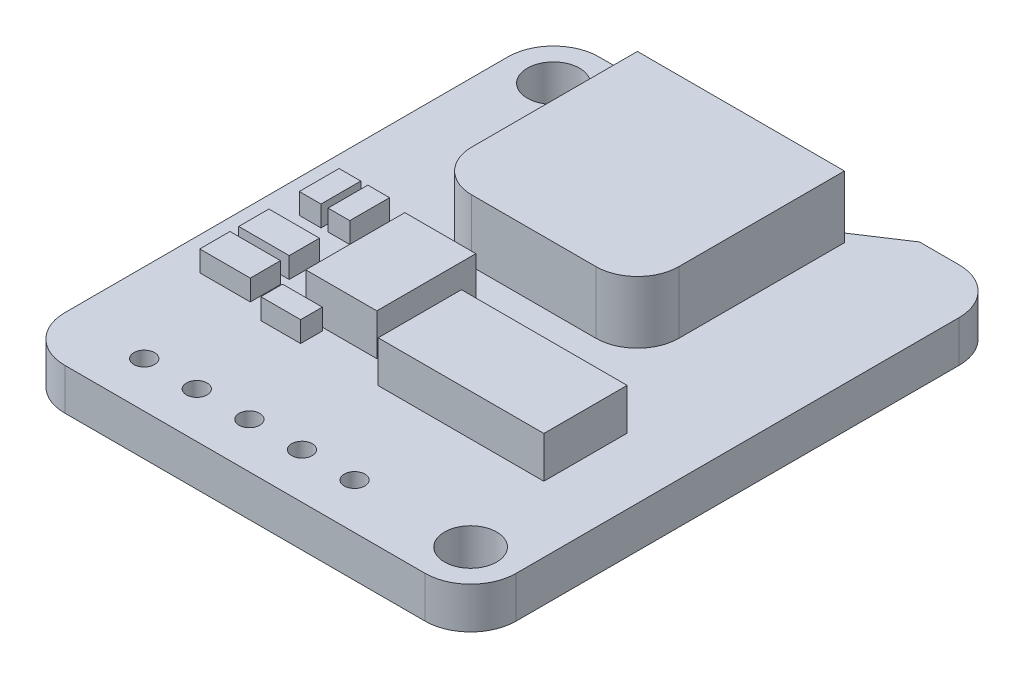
SolidWorks part; units mm, degrees
ref_plane "Front Plane" through (0, 0, 0) normal (0, 0, 1) x (1, 0, 0)
ref_plane "Top Plane" through (0, 0, 0) normal (0, 1, 0) x (1, 0, 0)
ref_plane "Right Plane" through (0, 0, 0) normal (1, 0, 0) x (0, 0, -1)
sketch "Sketch1" plane through (0, 0, 0) normal (0, 1, 0) x (1, 0, 0)
  line L0 (4.4809, 25.8) -> (6.2682, 24.0127)
  line L1 (2.2, 0) -> (19.6, 0)
  line L2 (0, 2.2) -> (0, 23.6)
  line L3 (2.2, 25.8) -> (4.4809, 25.8)
  line L4 (21.8, 2.2) -> (21.8, 23.6)
  line L5 (7.6824, 23.4269) -> (13.4754, 23.4269)
  line L6 (14.5743, 23.7558) -> (17.6827, 25.8)
  line L7 (17.6827, 25.8) -> (19.6, 25.8)
  line L8 (3.8369, 2.2) -> (6.3769, 2.2) construction
  arc A0 (0, 23.6) -> (2.2, 25.8) centre (2.2, 23.6) cw
  arc A1 (19.6, 25.8) -> (21.8, 23.6) centre (19.6, 23.6) cw
  arc A2 (19.6, 0) -> (21.8, 2.2) centre (19.6, 2.2) ccw
  arc A3 (2.2, 0) -> (0, 2.2) centre (2.2, 2.2) cw
  arc A4 (13.4754, 23.4269) -> (14.5743, 23.7558) centre (13.4754, 25.4269) ccw
  arc A5 (6.2682, 24.0127) -> (7.6824, 23.4269) centre (7.6824, 25.4269) ccw
  circle A6 centre (2.2, 23.6) radius 1.2596
  circle A7 centre (19.6, 2.2) radius 1.2596
  circle A8 centre (3.8369, 2.2) radius 0.5
  circle A9 centre (6.3769, 2.2) radius 0.5
  circle A10 centre (8.9169, 2.2) radius 0.5
  circle A11 centre (11.4569, 2.2) radius 0.5
  circle A12 centre (13.9969, 2.2) radius 0.5
  point P9 (21.8, 25.8)
  point P12 (21.8, 0)
  point P15 (0, 0)
  dimension "D3" = 2.2
  dimension "D4" = 2
  dimension "D5" = 1
  dimension "D1" = 21.8
  dimension "D2" = 25.8
  dimension "D7" = 2.54
  dimension "D6" = 5
extrude "Board" add sketch "Sketch1" along normal blind 2
sketch "Sketch2" plane through (0, 2, 0) normal (0, 1, 0) x (1, 0, 0)
  line L1 (7.9, 13.9559) -> (13.9, 13.9559)
  line L2 (5.9, 15.9559) -> (5.9, 23.9559)
  line L3 (5.9, 23.9559) -> (15.9, 23.9559)
  line L4 (15.9, 15.9559) -> (15.9, 23.9559)
  line L5 (2.2, 0) -> (19.6, 0) construction
  arc A0 (13.9, 13.9559) -> (15.9, 15.9559) centre (13.9, 15.9559) ccw
  arc A1 (7.9, 13.9559) -> (5.9, 15.9559) centre (7.9, 15.9559) cw
  point P4 (10.9, 13.9559)
  point P10 (15.9, 13.9559)
  point P13 (5.9, 13.9559)
  point P16 (10.9, 0)
  dimension "D3" = 2
  dimension "D1" = 10
  dimension "D2" = 10
extrude "Cell mount" add sketch "Sketch2" along normal blind 3
sketch "Sketch3" plane through (0, 2, 0) normal (0, 1, 0) x (1, 0, 0)
  line L1 (6.0262, 12.5979) -> (9.4566, 12.5979)
  line L2 (6.0262, 12.5979) -> (6.0262, 7.813)
  line L3 (6.0262, 7.813) -> (9.4566, 7.813)
  line L4 (9.4566, 12.5979) -> (9.4566, 7.813)
  line L5 (10.6174, 6.7187) -> (18.6195, 6.7187)
  line L6 (10.6174, 6.7187) -> (10.6174, 10.7409)
  line L7 (10.6174, 10.7409) -> (18.6195, 10.7409)
  line L8 (18.6195, 6.7187) -> (18.6195, 10.7409)
extrude "Chips" add sketch "Sketch3" along normal blind 2
sketch "Sketch4" plane through (0, 2, 0) normal (0, 1, 0) x (1, 0, 0)
  line L1 (1.5933, 11.9339) -> (2.6421, 11.9339)
  line L2 (1.5933, 11.9339) -> (1.5933, 13.8548)
  line L3 (1.5933, 13.8548) -> (2.6421, 13.8548)
  line L4 (2.6421, 11.9339) -> (2.6421, 13.8548)
  line L5 (2.9826, 11.9339) -> (4.0314, 11.9339)
  line L6 (2.9826, 11.9339) -> (2.9826, 13.8548)
  line L7 (2.9826, 13.8548) -> (4.0314, 13.8548)
  line L8 (4.0314, 11.9339) -> (4.0314, 13.8548)
  line L9 (6.9867, 7.6531) -> (5.0657, 7.6531)
  line L10 (6.9867, 7.6531) -> (6.9867, 6.6043)
  line L11 (6.9867, 6.6043) -> (5.0657, 6.6043)
  line L12 (5.0657, 7.6531) -> (5.0657, 6.6043)
  line L13 (1.5933, 7.1287) -> (4.0314, 7.1287)
  line L14 (1.5933, 7.1287) -> (1.5933, 8.5877)
  line L15 (1.5933, 8.5877) -> (4.0314, 8.5877)
  line L16 (4.0314, 7.1287) -> (4.0314, 8.5877)
  line L17 (1.5933, 9.0086) -> (4.0314, 9.0086)
  line L18 (1.5933, 9.0086) -> (1.5933, 10.4677)
  line L19 (1.5933, 10.4677) -> (4.0314, 10.4677)
  line L20 (4.0314, 9.0086) -> (4.0314, 10.4677)
  point P21 (5.0657, 7.1287)
  point P23 (6.0262, 7.6531)
extrude "Resistors" add sketch "Sketch4" along normal blind 1
